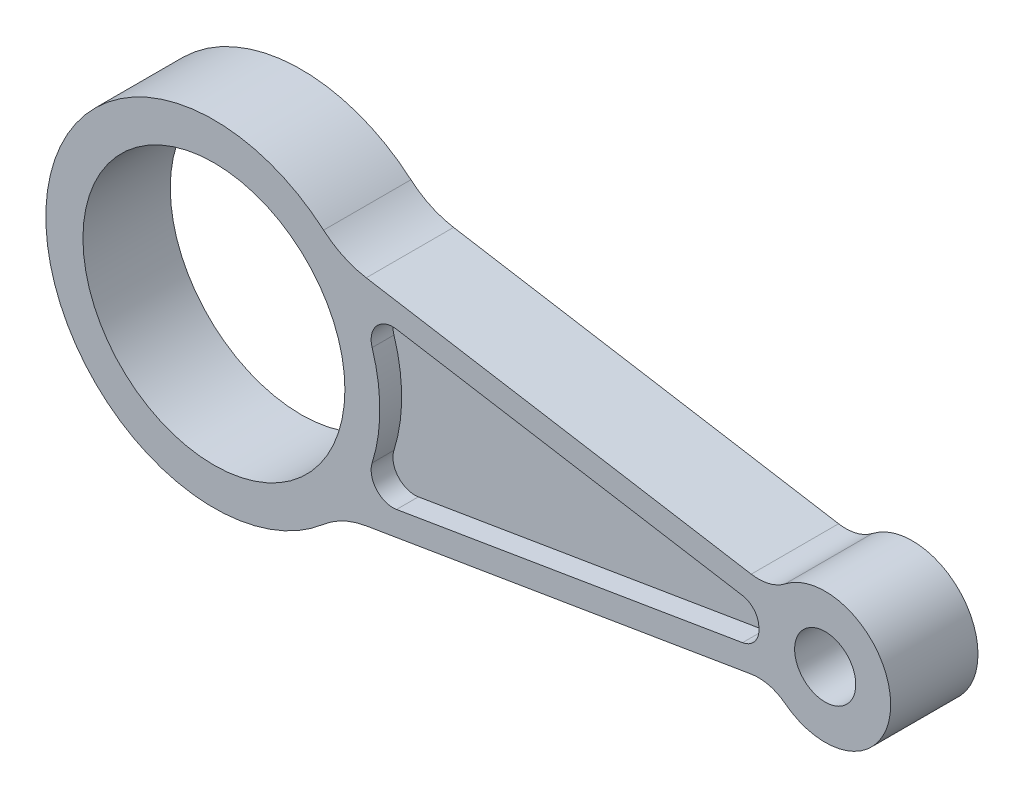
SolidWorks part; units mm, degrees
ref_plane "Front" through (0, 0, 0) normal (0, 0, 1) x (1, 0, 0)
ref_plane "Top" through (0, 0, 0) normal (0, 1, 0) x (1, 0, 0)
ref_plane "Right" through (0, 0, 0) normal (1, 0, 0) x (0, 0, -1)
sketch "Sketch1"
  dimension "D1" = 77
  dimension "D3" = 60
  dimension "D4" = 14
  dimension "D5" = 30
  dimension "D2" = 140
extrude "Base-Extrude" add sketch "Sketch1" against normal blind 20
fillet "Fillet1" radius 10 2 edges at (128.0638, 9.0844, -10) (128.0638, -9.0844, -10)
fillet "Fillet2" radius 20 2 edges at (28.7306, 25.6282, -10) (28.7306, -25.6282, -10)
sketch "Sketch2"
  dimension "D1" = 76
  dimension "D2" = 30
  dimension "D5" = 5
  dimension "D6" = 5
  dimension "D7" = 4.5
  dimension "D8" = 4.5
  dimension "D3" = 5.5
  dimension "D4" = 5.5
extrude "Cut-Extrude1" cut sketch "Sketch2" against normal blind 5
sketch "Sketch3"
  dimension "D1" = 76
  dimension "D2" = 5
  dimension "D5" = 4.5
  dimension "D6" = 4.5
  dimension "D7" = 5
  dimension "D3" = 5.5
  dimension "D4" = 5.5
extrude "Cut-Extrude2" cut sketch "Sketch3" against normal blind 5
sketch "Sketch4"
  dimension "D1" = 14
